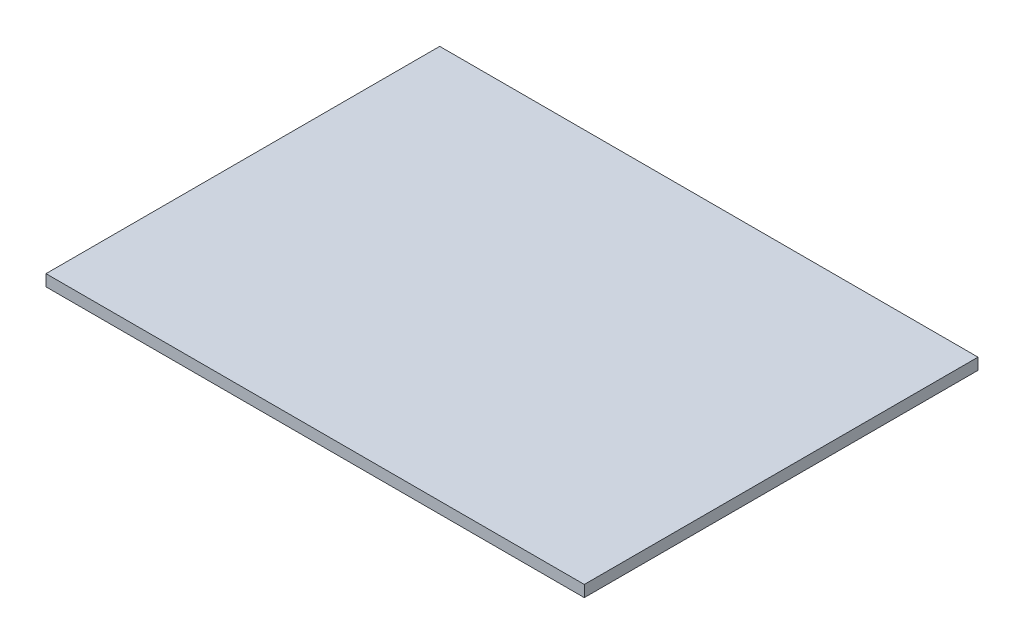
SolidWorks part; units mm, degrees
ref_plane "Front Plane" through (0, 0, 0) normal (0, 0, 1) x (1, 0, 0)
ref_plane "Top Plane" through (0, 0, 0) normal (0, 1, 0) x (1, 0, 0)
ref_plane "Right Plane" through (0, 0, 0) normal (1, 0, 0) x (0, 0, -1)
sketch "Sketch2" plane through (-45.85, 0, 0) normal (-1, 0, 0) x (0, 0, 1)
  line L0 (-25.05, 1.2) -> (25.05, 1.2) construction
  line L1 (-27.55, 39.8) -> (27.45, 39.8)
  line L2 (-27.55, 39.8) -> (-27.55, 38.2)
  line L3 (-27.55, 38.2) -> (27.45, 38.2)
  line L4 (27.45, 39.8) -> (27.45, 38.2)
  line L5 (-25.05, 1.2) -> (-25.05, 0) construction
  dimension "D1" = 1.6
  dimension "D2" = 55
  dimension "D3" = 37
  dimension "D4" = 2.5
extrude "Boss-Extrude1" add sketch "Sketch2" against normal blind 75.2 contours L1 L4 L3 L2
